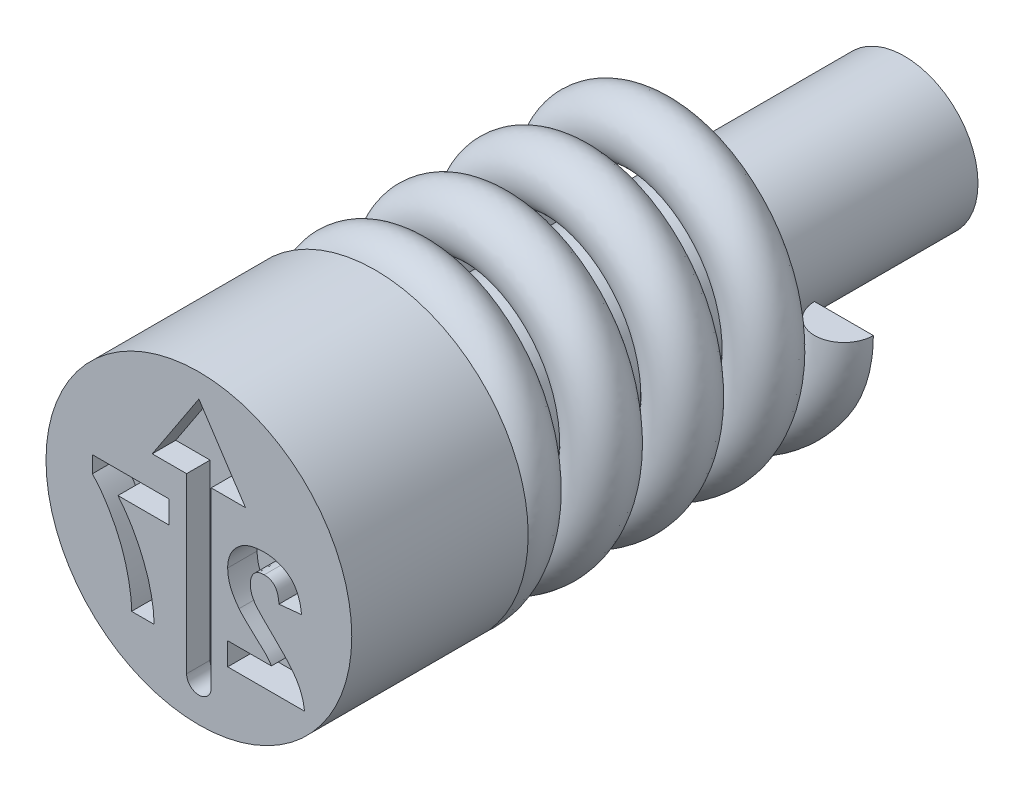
SolidWorks part; units mm, degrees
other "<DCSPR10>-<Cut-Extrude1>"
ref_plane "Front Plane" through (0, 0, 0) normal (0, 0, 1) x (1, 0, 0)
ref_plane "Top Plane" through (0, 0, 0) normal (0, 1, 0) x (1, 0, 0)
ref_plane "Right Plane" through (0, 0, 0) normal (1, 0, 0) x (0, 0, -1)
sketch "Sketch2" plane through (0, 0, 0) normal (0, 1, 0) x (1, 0, 0)
  line L5 (2.6, 0) -> (2.6, 3)
  line L6 (2.6, 3) -> (1.25, 3)
  line L7 (1.25, 3) -> (1.25, 12)
  line L8 (1.25, 12) -> (0, 12)
  line L9 (0, 0) -> (2.6, 0)
  line L10 (0, 0) -> (0, 50000) construction
  line L11 (0, 12) -> (0, 0)
  dimension "D1" = 3
  dimension "D2" = 12
  dimension "D3" = 5.2
  dimension "D4" = 2.5
revolve "Revolve1" add sketch "Sketch2" angle 360 about L10
sketch "Sketch3" plane through (0, 0, 0) normal (0, 0, 1) x (1, 0, 0)
  line L0 (-0.2093, 0.9958) -> (-0.7931, 0.9958)
  line L1 (0, -0.9219) -> (0, 0.9385) construction
  line L2 (-0.2093, -1.9514) -> (-0.2093, 0.9958)
  line L3 (-0.7931, 0.9958) -> (0, 2.1996)
  line L12 (0.7931, 0.9958) -> (0, 2.1996)
  line L16 (0.2093, -1.9514) -> (0.2093, 0.9958)
  line L17 (0.2093, 0.9958) -> (0.7931, 0.9958)
  arc A2 (-0.2093, -1.9514) -> (0.2093, -1.9514) centre (0, -1.9514) ccw
extrude "Cut-Extrude1" cut sketch "Sketch3" against normal blind 0.4
sketch "Sketch4" plane through (0, 0, 0) normal (0, 0, 1) x (1, 0, 0)
  text T0 "2  7" font "Arial" height 2
  dimension "D1" = 1.5
  dimension "D2" = 1.9
extrude "Cut-Extrude2" cut sketch "Sketch4" against normal blind 0.5
inserted part "DCSPR10"
move or copy body "Body-Move/Copy2" placed by mates yes
